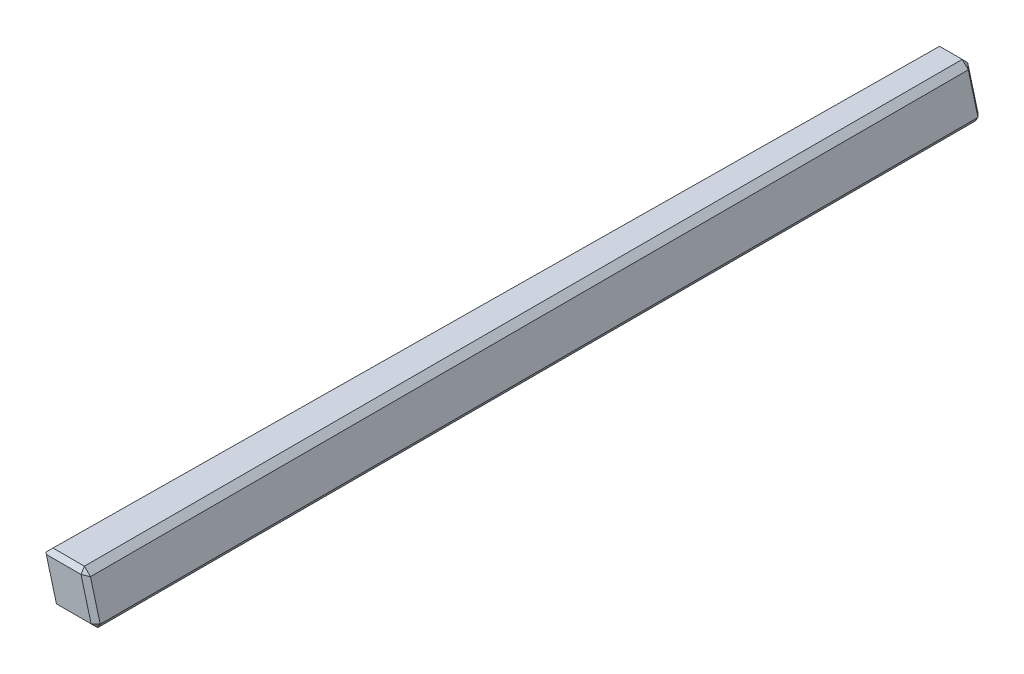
SolidWorks part; units mm, degrees
ref_plane "Plan de face" through (0, 0, 0) normal (0, 0, 1) x (1, 0, 0)
ref_plane "Plan de dessus" through (0, 0, 0) normal (0, 1, 0) x (1, 0, 0)
ref_plane "Plan de droite" through (0, 0, 0) normal (1, 0, 0) x (0, 0, -1)
sketch "Esquisse1" plane through (0, 0, 0) normal (0, 0, 1) x (1, 0, 0)
  line L0 (-20, 0) -> (-27.0471, 26.3)
  line L1 (-27.0471, 26.3) -> (-7.0471, 26.3)
  line L2 (-7.0471, 26.3) -> (0, 0)
  line L3 (0, 0) -> (-20, 0)
  line L4 (-20, 0) -> (-20, 53.7923) construction
  line L5 (-7.0471, 26.3) -> (-7.0471, -28.5865) construction
  dimension "D1" = 15
  dimension "D2" = 15
  dimension "D3" = 26.3
  dimension "D4" = 20
ref_plane "Plan1" through (0, 0, 475) normal (0, 0, 1) x (1, 0, 0)
sketch "Esquisse2" plane through (0, 0, 475) normal (0, 0, 1) x (1, 0, 0)
  line L0 (-7.0471, 26.3) -> (0, 0) construction
  line L2 (-20, 0) -> (-27.0471, 26.3) construction
  line L4 (-27.0471, 26.3) -> (-20, 0)
  line L5 (-7.0471, 26.3) -> (-27.0471, 26.3)
  line L6 (0, 0) -> (-7.0471, 26.3)
  line L7 (-20, 0) -> (0, 0)
  line L8 (-31.7971, 26.3) -> (-24.75, 0)
  line L9 (-7.0471, 26.3) -> (-31.7971, 26.3)
  line L10 (0, 0) -> (-7.0471, 26.3)
  line L11 (-24.75, 0) -> (0, 0)
  dimension "D2" = 4.75
  dimension "D1" = 0
ref_plane "Plan2" through (0, 0, -25) normal (0, 0, 1) x (1, 0, 0)
sketch "Esquisse3" plane through (0, 0, -25) normal (0, 0, 1) x (1, 0, 0)
  line L0 (-31.7971, 26.3) -> (-24.75, 0) construction
  line L1 (-7.0471, 26.3) -> (0, 0) construction
  line L4 (-27.0471, 26.3) -> (-20, 0)
  line L5 (-7.0471, 26.3) -> (-27.0471, 26.3)
  line L6 (0, 0) -> (-7.0471, 26.3)
  line L7 (-20, 0) -> (0, 0)
  line L8 (-26.7971, 26.3) -> (-19.75, 0)
  line L9 (-7.0471, 26.3) -> (-26.7971, 26.3)
  line L10 (0, 0) -> (-7.0471, 26.3)
  line L11 (-19.75, 0) -> (0, 0)
  dimension "D2" = 5
  dimension "D1" = 0
loft "Lissage2" add profiles "Esquisse2", "Esquisse3"
chamfer "Chanfrein1" distance 2.5 angle 45 12 edges
chamfer "Chanfrein2" distance 4.5 angle 45 1 edges
equation "\"D2@Esquisse2\" = \"D1@Plan1\" * 0.01"
equation "\"D2@Esquisse3\" = \"D1@Plan2\" * 0.01"
